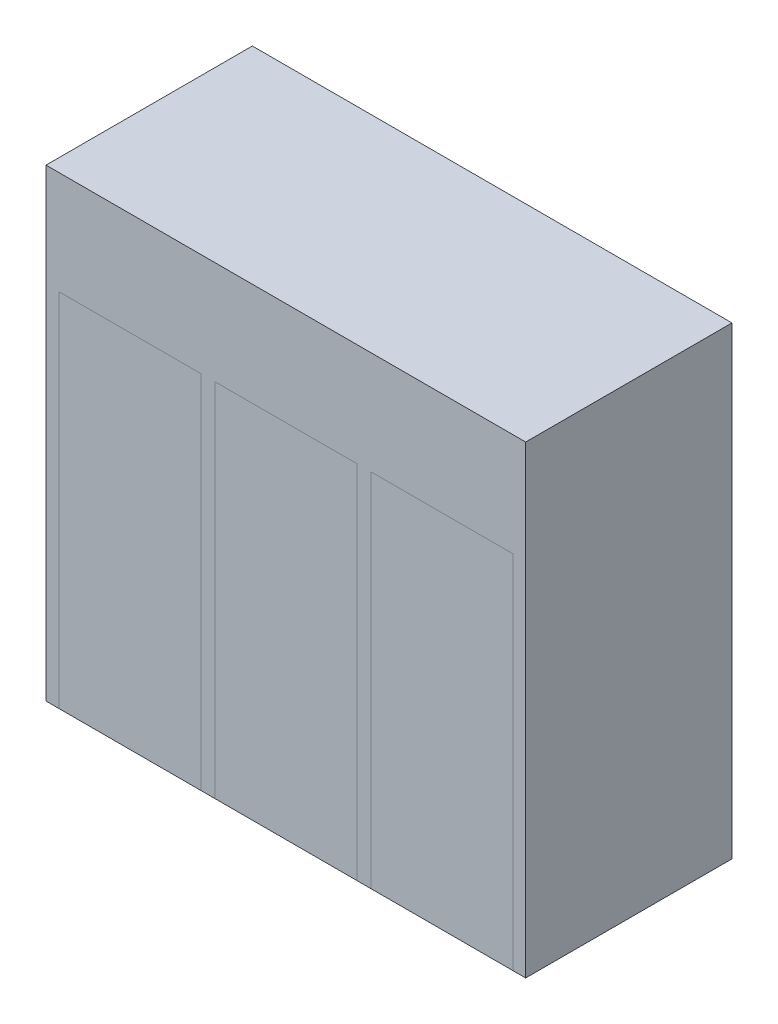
SolidWorks part; units mm, degrees
ref_plane "Ebene vorne" through (0, 0, 0) normal (0, 0, 1) x (1, 0, 0)
ref_plane "Ebene oben" through (0, 0, 0) normal (0, 1, 0) x (1, 0, 0)
ref_plane "Ebene rechts" through (0, 0, 0) normal (1, 0, 0) x (0, 0, -1)
sketch "Skizze1" plane through (0, 0, 0) normal (0, 0, 1) x (1, 0, 0)
  line L1 (-8.4614, 5.4539) -> (10.1386, 5.4539)
  line L2 (-8.4614, 5.4539) -> (-8.4614, -12.5461)
  line L3 (-8.4614, -12.5461) -> (10.1386, -12.5461)
  line L4 (10.1386, 5.4539) -> (10.1386, -12.5461)
  dimension "D1" = 18.6
  dimension "D2" = 18
extrude "Aufsatz-Linear austragen1" add sketch "Skizze1" along normal blind 8 contours L1 L4 L3 L2
sketch "Skizze2" plane through (0, 0, 8) normal (0, 0, 1) x (1, 0, 0)
  line L0 (-8.4614, -12.5461) -> (10.1386, -12.5461) construction
  line L1 (-7.9614, 1.4539) -> (-2.4614, 1.4539)
  line L2 (-7.9614, 1.4539) -> (-7.9614, -12.5461)
  line L3 (-7.9614, -12.5461) -> (-2.4614, -12.5461)
  line L4 (-2.4614, 1.4539) -> (-2.4614, -12.5461)
  line L5 (10.1386, 5.4539) -> (10.1386, -12.5461) construction
  line L6 (-1.9114, 1.4539) -> (3.5886, 1.4539)
  line L7 (-1.9114, 1.4539) -> (-1.9114, -12.5461)
  line L8 (-1.9114, -12.5461) -> (3.5886, -12.5461)
  line L9 (3.5886, 1.4539) -> (3.5886, -12.5461)
  line L10 (4.1386, 1.4539) -> (9.6386, 1.4539)
  line L11 (4.1386, 1.4539) -> (4.1386, -12.5461)
  line L12 (4.1386, -12.5461) -> (9.6386, -12.5461)
  line L13 (9.6386, 1.4539) -> (9.6386, -12.5461)
  line L14 (-8.4614, 5.4539) -> (-8.4614, -12.5461) construction
  point P18 (-0.7278, -12.5461)
  point P19 (14.069, 1.4539)
  point P20 (0.8386, -12.5461)
  point P21 (0.8386, -12.5461)
  dimension "D1" = 5.5
  dimension "D2" = 0.5
  dimension "D3" = 0.5
  dimension "D4" = 14
extrude "Schnitt-Linear austragen1" cut sketch "Skizze2" against normal blind 1
sketch "Skizze3" plane through (0, 0, 7) normal (0, 0, 1) x (1, 0, 0)
  line L1 (-7.9614, 1.4539) -> (-2.4614, 1.4539)
  line L2 (-7.9614, 1.4539) -> (-7.9614, -12.5461)
  line L3 (-7.9614, -12.5461) -> (-2.4614, -12.5461)
  line L4 (-2.4614, 1.4539) -> (-2.4614, -12.5461)
  line L5 (-1.9114, 1.4539) -> (3.5886, 1.4539)
  line L6 (-1.9114, 1.4539) -> (-1.9114, -12.5461)
  line L7 (-1.9114, -12.5461) -> (3.5886, -12.5461)
  line L8 (3.5886, 1.4539) -> (3.5886, -12.5461)
  line L9 (4.1386, 1.4539) -> (9.6386, 1.4539)
  line L10 (4.1386, 1.4539) -> (4.1386, -12.5461)
  line L11 (4.1386, -12.5461) -> (9.6386, -12.5461)
  line L12 (9.6386, 1.4539) -> (9.6386, -12.5461)
extrude "Aufsatz-Linear austragen2" add sketch "Skizze3" along normal up to surface (1 mm away) separate body
